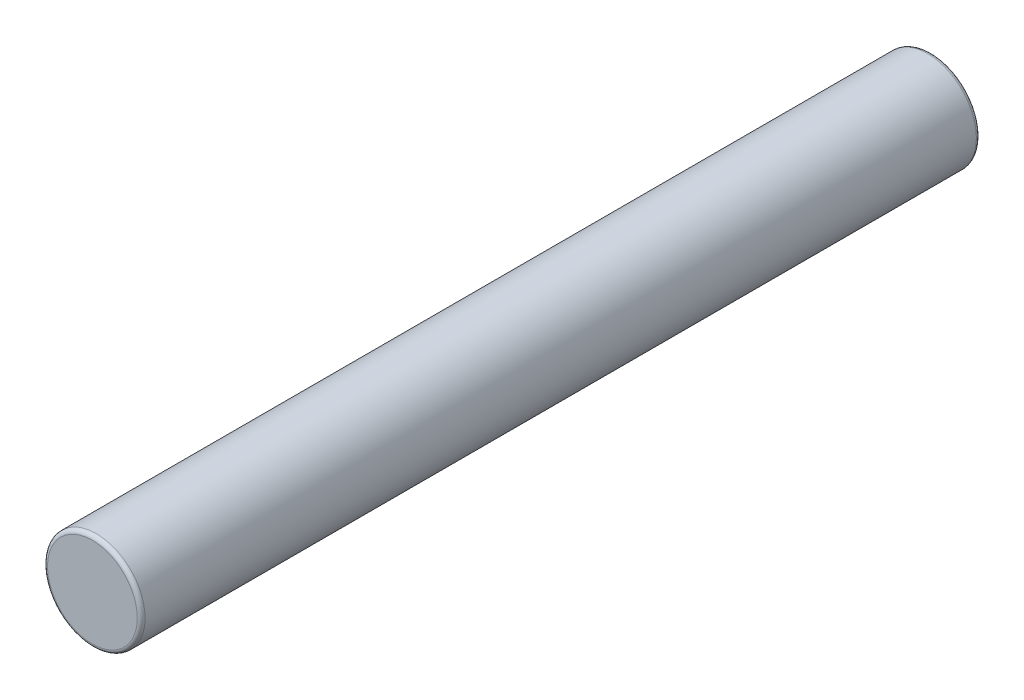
SolidWorks part; units mm, degrees
ref_plane "Face" through (0, 0, 0) normal (0, 0, 1) x (1, 0, 0)
ref_plane "Dessus" through (0, 0, 0) normal (0, 1, 0) x (1, 0, 0)
ref_plane "Droite" through (0, 0, 0) normal (1, 0, 0) x (0, 0, -1)
sketch "Esquisse1" plane through (0, 0, 0) normal (0, 0, 1) x (1, 0, 0)
  circle A0 centre (0, 0) radius 2.5
  dimension "D1" = 5
extrude "Extrusion1" add sketch "Esquisse1" along normal mid plane 43
fillet "Congé1" radius 0.2
